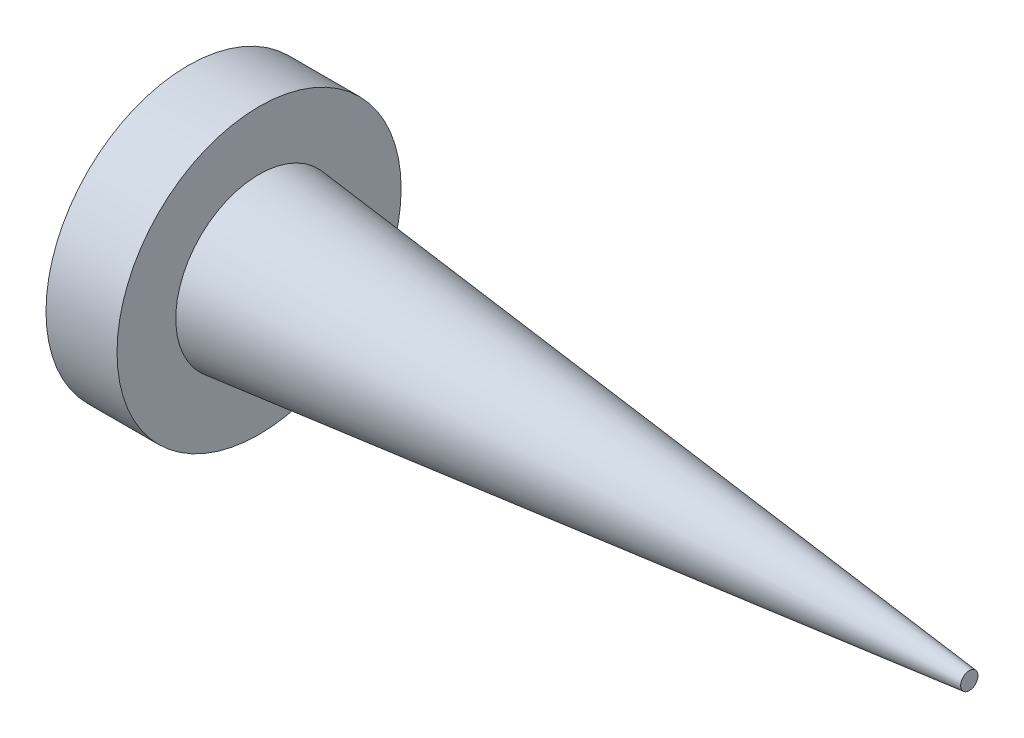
SolidWorks part; units mm, degrees
ref_plane "Plan de face" through (0, 0, 0) normal (0, 0, 1) x (1, 0, 0)
ref_plane "Plan de dessus" through (0, 0, 0) normal (0, 1, 0) x (1, 0, 0)
ref_plane "Plan de droite" through (0, 0, 0) normal (1, 0, 0) x (0, 0, -1)
sketch "Esquisse1" plane through (0, 0, 0) normal (1, 0, 0) x (0, 0, -1)
  circle A0 centre (0, 0) radius 2
extrude "Boss.-Extru.1" add sketch "Esquisse1" along normal blind 1
sketch "Esquisse2" plane through (1, 0, 0) normal (1, 0, 0) x (0, 0, -1)
  circle A0 centre (0, 0) radius 1.1732
  point P3 (0, 0)
extrude "Boss.-Extru.3" add sketch "Esquisse2" along normal blind 10 draft 6
